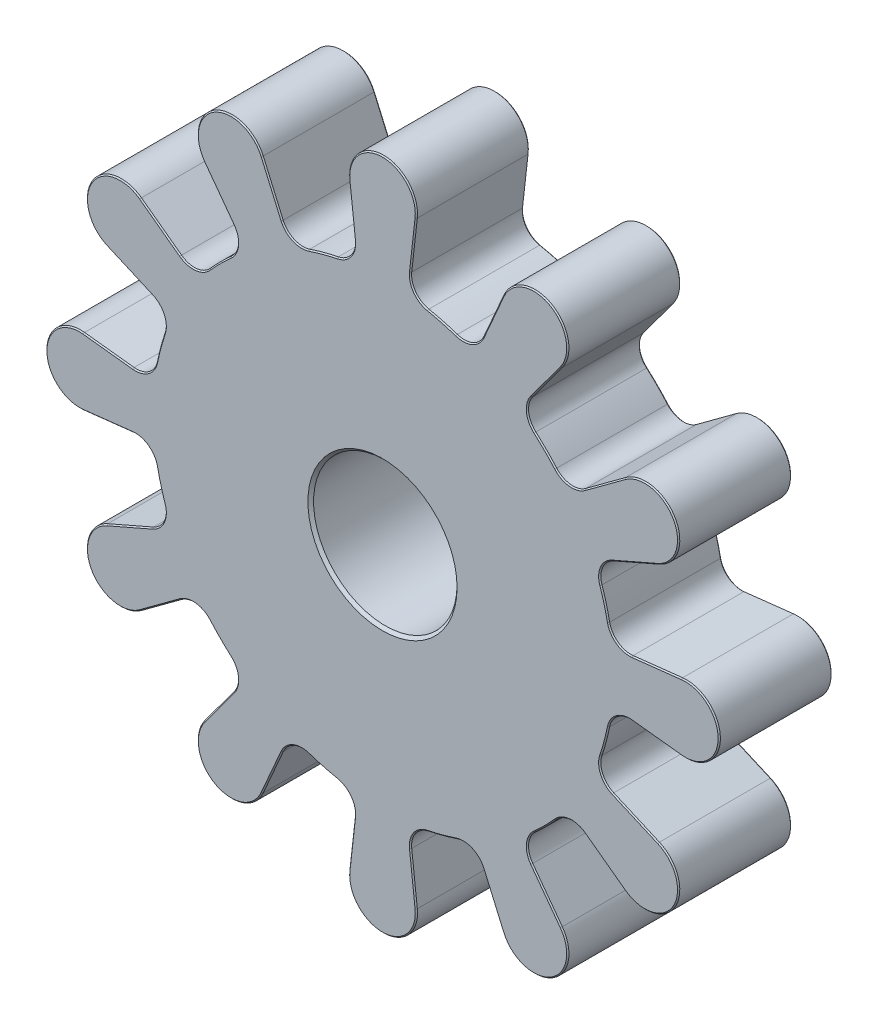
SolidWorks part; units mm, degrees
ref_plane "Спереди" through (0, 0, 0) normal (0, 0, 1) x (1, 0, 0)
ref_plane "Сверху" through (0, 0, 0) normal (0, 1, 0) x (1, 0, 0)
ref_plane "Справа" through (0, 0, 0) normal (1, 0, 0) x (0, 0, -1)
sketch "Эскиз1" plane through (0, 0, 0) normal (0, 0, 1) x (1, 0, 0)
  line L0 (-2.4877, 22.0838) -> (-2.9811, 26.4642)
  line L1 (2.4877, 22.0838) -> (2.9811, 26.4642)
  line L2 (8.8875, 20.369) -> (10.6503, 24.4092)
  line L3 (13.1963, 17.8813) -> (15.8138, 21.4281)
  line L4 (17.8813, 13.1963) -> (21.4281, 15.8138)
  line L5 (20.369, 8.8875) -> (24.4092, 10.6503)
  line L6 (22.0838, 2.4877) -> (26.4642, 2.9811)
  line L7 (22.0838, -2.4877) -> (26.4642, -2.9811)
  line L8 (20.369, -8.8875) -> (24.4092, -10.6503)
  line L9 (17.8813, -13.1963) -> (21.4281, -15.8138)
  line L10 (13.1963, -17.8813) -> (15.8138, -21.4281)
  line L11 (8.8875, -20.369) -> (10.6503, -24.4092)
  line L12 (2.4877, -22.0838) -> (2.9811, -26.4642)
  line L13 (-2.4877, -22.0838) -> (-2.9811, -26.4642)
  line L14 (-8.8875, -20.369) -> (-10.6503, -24.4092)
  line L15 (-13.1963, -17.8813) -> (-15.8138, -21.4281)
  line L16 (-17.8813, -13.1963) -> (-21.4281, -15.8138)
  line L17 (-20.369, -8.8875) -> (-24.4092, -10.6503)
  line L18 (-22.0838, -2.4877) -> (-26.4642, -2.9811)
  line L19 (-22.0838, 2.4877) -> (-26.4642, 2.9811)
  line L20 (-20.369, 8.8875) -> (-24.4092, 10.6503)
  line L21 (-17.8813, 13.1963) -> (-21.4281, 15.8138)
  line L22 (-13.1963, 17.8813) -> (-15.8138, 21.4281)
  line L23 (-8.8875, 20.369) -> (-10.6503, 24.4092)
  line L30 (0, 29.8) -> (0, -29.8) construction
  line L32 (-1.4624, 12.982) -> (-1.5622, 13.8676)
  line L33 (1.4317, 12.7095) -> (1.5689, 13.9272)
  line L34 (2.3239, 11.6557) -> (2.593, 12.5054)
  line L35 (4.9057, 11.2158) -> (5.5263, 12.2724)
  line L36 (6.2004, 11.2432) -> (6.7918, 11.91)
  line L37 (9.0751, 10.1496) -> (10.0717, 10.8624)
  line L38 (11.2208, 9.8112) -> (12.0323, 10.1797)
  line L39 (13.9629, 7.2631) -> (15.1634, 7.5089)
  line L40 (16.2525, 5.5827) -> (17.1438, 5.5893)
  line L41 (17.7555, 1.4461) -> (18.9522, 1.1824)
  line L42 (19.0102, -1.611) -> (19.8271, -1.9675)
  line L43 (18.2626, -6.5503) -> (19.2485, -7.278)
  line L44 (17.6157, -10.1259) -> (18.217, -10.7837)
  line L45 (14.2837, -14.4783) -> (14.8884, -15.544)
  line L46 (11.6517, -17.2868) -> (11.9335, -18.1324)
  line L47 (6.3321, -19.6361) -> (6.4511, -20.8557)
  line L48 (2.4948, -20.5871) -> (2.4082, -21.4742)
  line L49 (-3.4495, -20.0963) -> (-3.8368, -21.2588)
  line L50 (-7.18, -18.812) -> (-7.6198, -19.5872)
  line L51 (-12.1357, -15.5876) -> (-12.9624, -16.4921)
  line L52 (-14.4984, -12.5786) -> (-15.2156, -13.1079)
  line L53 (-17.2328, -7.622) -> (-18.3559, -8.1121)
  line L54 (-17.5696, -4.0382) -> (-18.44, -4.23)
  line L55 (-17.6785, 1.1912) -> (-18.9038, 1.2003)
  line L56 (-16.1808, 4.1039) -> (-17.0539, 4.2827)
  line L57 (-14.148, 8.2966) -> (-15.2637, 8.8033)
  line L58 (-11.6856, 9.756) -> (-12.4105, 10.2745)
  line L59 (-8.5447, 12.2342) -> (-9.3578, 13.1509)
  line L60 (-6.1789, 12.2251) -> (-6.6303, 12.9936)
  line L61 (-2.9665, 13.0878) -> (-3.3364, 14.256)
  line L62 (-2.4877, 22.0838) -> (-2.9811, 26.4642)
  line L63 (2.4877, 22.0838) -> (2.9811, 26.4642)
  line L64 (8.8875, 20.369) -> (10.6503, 24.4092)
  line L65 (13.1963, 17.8813) -> (15.8138, 21.4281)
  line L66 (17.8813, 13.1963) -> (21.4281, 15.8138)
  line L67 (20.369, 8.8875) -> (24.4092, 10.6503)
  circle A0 centre (0, 0) radius 26.8 construction
  arc A1 (2.9811, 26.4642) -> (-2.9811, 26.4642) centre (0, 26.8) ccw
  arc A2 (-4.0066, 20.0027) -> (-6.5315, 19.3261) centre (0, 0) ccw
  arc A3 (15.8138, 21.4281) -> (10.6503, 24.4092) centre (13.4, 23.2095) ccw
  arc A4 (24.4092, 10.6503) -> (21.4281, 15.8138) centre (23.2095, 13.4) ccw
  arc A5 (26.4642, -2.9811) -> (26.4642, 2.9811) centre (26.8, 0) ccw
  arc A6 (21.4281, -15.8138) -> (24.4092, -10.6503) centre (23.2095, -13.4) ccw
  arc A7 (10.6503, -24.4092) -> (15.8138, -21.4281) centre (13.4, -23.2095) ccw
  arc A8 (-2.9811, -26.4642) -> (2.9811, -26.4642) centre (0, -26.8) ccw
  arc A9 (-15.8138, -21.4281) -> (-10.6503, -24.4092) centre (-13.4, -23.2095) ccw
  arc A10 (-24.4092, -10.6503) -> (-21.4281, -15.8138) centre (-23.2095, -13.4) ccw
  arc A11 (-26.4642, 2.9811) -> (-26.4642, -2.9811) centre (-26.8, 0) ccw
  arc A12 (-21.4281, 15.8138) -> (-24.4092, 10.6503) centre (-23.2095, 13.4) ccw
  arc A13 (-10.6503, 24.4092) -> (-15.8138, 21.4281) centre (-13.4, 23.2095) ccw
  arc A17 (6.5315, 19.3261) -> (4.0066, 20.0027) centre (0, 0) ccw
  arc A18 (15.3195, 13.4711) -> (13.4711, 15.3195) centre (0, 0) ccw
  arc A20 (20.0027, 4.0066) -> (19.3261, 6.5315) centre (0, 0) ccw
  arc A21 (-13.4711, 15.3195) -> (-15.3195, 13.4711) centre (0, 0) ccw
  arc A22 (-19.3261, 6.5315) -> (-20.0027, 4.0066) centre (0, 0) ccw
  arc A24 (-20.0027, -4.0066) -> (-19.3261, -6.5315) centre (0, 0) ccw
  arc A25 (-15.3195, -13.4711) -> (-13.4711, -15.3195) centre (0, 0) ccw
  arc A26 (-6.5315, -19.3261) -> (-4.0066, -20.0027) centre (0, 0) ccw
  arc A28 (4.0066, -20.0027) -> (6.5315, -19.3261) centre (0, 0) ccw
  arc A29 (13.4711, -15.3195) -> (15.3195, -13.4711) centre (0, 0) ccw
  arc A30 (19.3261, -6.5315) -> (20.0027, -4.0066) centre (0, 0) ccw
  arc A31 (8.8875, -20.369) -> (6.5315, -19.3261) centre (7.1415, -21.1308) ccw
  arc A32 (2.4877, -22.0838) -> (4.0066, -20.0027) centre (4.3807, -21.8706) cw
  circle A33 centre (0, 0) radius 6.35
  arc A36 (-2.4877, -22.0838) -> (-4.0066, -20.0027) centre (-4.3807, -21.8706) ccw
  arc A37 (-8.8875, -20.369) -> (-6.5315, -19.3261) centre (-7.1415, -21.1308) cw
  arc A38 (-13.1963, -17.8813) -> (-13.4711, -15.3195) centre (-14.7291, -16.7501) ccw
  arc A39 (-17.8813, -13.1963) -> (-15.3195, -13.4711) centre (-16.7501, -14.7291) cw
  arc A40 (-20.369, -8.8875) -> (-19.3261, -6.5315) centre (-21.1308, -7.1415) ccw
  arc A41 (-22.0838, -2.4877) -> (-20.0027, -4.0066) centre (-21.8706, -4.3807) cw
  arc A44 (-22.0838, 2.4877) -> (-20.0027, 4.0066) centre (-21.8706, 4.3807) ccw
  arc A45 (-20.369, 8.8875) -> (-19.3261, 6.5315) centre (-21.1308, 7.1415) cw
  arc A46 (13.1963, -17.8813) -> (13.4711, -15.3195) centre (14.7291, -16.7501) cw
  arc A47 (17.8813, -13.1963) -> (15.3195, -13.4711) centre (16.7501, -14.7291) ccw
  arc A48 (20.369, -8.8875) -> (19.3261, -6.5315) centre (21.1308, -7.1415) cw
  arc A49 (22.0838, -2.4877) -> (20.0027, -4.0066) centre (21.8706, -4.3807) ccw
  arc A50 (20.369, 8.8875) -> (19.3261, 6.5315) centre (21.1308, 7.1415) ccw
  arc A53 (17.8813, 13.1963) -> (15.3195, 13.4711) centre (16.7501, 14.7291) cw
  arc A54 (13.1963, 17.8813) -> (13.4711, 15.3195) centre (14.7291, 16.7501) ccw
  arc A55 (-17.8813, 13.1963) -> (-15.3195, 13.4711) centre (-16.7501, 14.7291) ccw
  arc A56 (-13.1963, 17.8813) -> (-13.4711, 15.3195) centre (-14.7291, 16.7501) cw
  arc A57 (-8.8875, 20.369) -> (-6.5315, 19.3261) centre (-7.1415, 21.1308) ccw
  arc A58 (-2.4877, 22.0838) -> (-4.0066, 20.0027) centre (-4.3807, 21.8706) cw
  arc A59 (8.8875, 20.369) -> (6.5315, 19.3261) centre (7.1415, 21.1308) cw
  arc A60 (2.4877, 22.0838) -> (4.0066, 20.0027) centre (4.3807, 21.8706) ccw
  arc A61 (22.0838, 2.4877) -> (20.0027, 4.0066) centre (21.8706, 4.3807) cw
  arc A66 (2.9811, 26.4642) -> (-2.9811, 26.4642) centre (0, 26.8) ccw
  arc A67 (12.4877, 24.1249) -> (7.0408, 26.55) centre (9.9008, 25.6442) ccw
  arc A68 (20.2208, 18.1212) -> (16.2313, 22.552) centre (18.4756, 20.5613) ccw
  arc A69 (24.8435, 9.4912) -> (23.001, 15.1617) centre (24.2417, 12.4302) ccw
  arc A70 (25.5564, -0.2729) -> (26.1796, 5.6567) centre (26.202, 2.6568) ccw
  arc A71 (22.2362, -9.4828) -> (25.2173, -4.3193) centre (24.0176, -7.069) ccw
  arc A72 (15.4571, -16.5461) -> (20.2807, -13.0415) centre (18.0662, -15.0655) ccw
  arc A73 (6.3911, -20.2414) -> (12.2231, -19.0017) centre (9.3769, -19.95) ccw
  arc A74 (-3.394, -19.9297) -> (2.438, -21.1693) centre (-0.5478, -20.878) ccw
  arc A75 (-12.2064, -15.665) -> (-7.3828, -19.1696) centre (-9.992, -17.689) ccw
  arc A76 (-18.5224, -8.1847) -> (-15.5412, -13.3482) centre (-17.3226, -10.9344) ccw
  arc A77 (-21.2497, 1.2178) -> (-20.6265, -4.7118) centre (-21.2721, -1.7821) ccw
  arc A78 (-19.917, 10.9168) -> (-21.7594, 5.2463) centre (-21.1576, 8.1853) ccw
  arc A79 (-14.7545, 19.2351) -> (-18.744, 14.8043) centre (-16.9988, 17.2444) ccw
  arc A80 (-6.655, 24.7346) -> (-12.1018, 22.3095) centre (-9.515, 23.8288) ccw
  arc A81 (2.9811, 26.4642) -> (-2.9811, 26.4642) centre (0, 26.8) ccw
  arc A82 (15.8138, 21.4281) -> (10.6503, 24.4092) centre (13.4, 23.2095) ccw
  arc A83 (24.4092, 10.6503) -> (21.4281, 15.8138) centre (23.2095, 13.4) ccw
  dimension "D1" = 53.6
  dimension "D2" = 6
  dimension "D3" = 20.4
  dimension "D5" = 12.7
  dimension "D6" = 12
  dimension "D7" = 1.905
  dimension "D8" = 1.905
  dimension "D4" = 15
extrude "Бобышка-Вытянуть1" add sketch "Эскиз1" along normal blind 10
chamfer "Фаска1" distance 0.25 angle 45 2 edges at (6.35, 0, 0) (6.35, 0, 10)
chamfer "Фаска2" distance 0.1 angle 45 144 edges at (14.9, -25.8076, 0) (14.5051, -19.6547, 0) (9.7689, -22.3891, 0) (12.835, -16.5469, 0) (7.9126, -19.3889, 0) (14.425, -14.425, 0) (5.2799, -19.7049, 0) (16.5469, -12.835, 0) (2.842, -20.7475, 0) (19.6547, -14.5051, 0) (2.7344, -24.274, 0) (25.8076, -14.9, 0) (0, -29.8, 0) (22.3891, -9.7689, 0) (-2.7344, -24.274, 0) (19.3889, -7.9126, 0) (-2.842, -20.7475, 0) (19.7049, -5.2799, 0) (-5.2799, -19.7049, 0) (20.7475, -2.842, 0) (-7.9126, -19.3889, 0) (24.274, -2.7344, 0) (-9.7689, -22.3891, 0) (29.8, 0, 0) (-14.9, -25.8076, 0) (24.274, 2.7344, 0) (-14.5051, -19.6547, 0) (20.7475, 2.842, 0) (-12.835, -16.5469, 0) (19.7049, 5.2799, 0) (-14.425, -14.425, 0) (19.3889, 7.9126, 0) (-16.5469, -12.835, 0) (22.3891, 9.7689, 0) (-19.6547, -14.5051, 0) (25.8076, 14.9, 0) (-25.8076, -14.9, 0) (19.6547, 14.5051, 0) (-22.3891, -9.7689, 0) (16.5469, 12.835, 0) (-19.3889, -7.9126, 0) (14.425, 14.425, 0) (-19.7049, -5.2799, 0) (12.835, 16.5469, 0) (-20.7475, -2.842, 0) (14.5051, 19.6547, 0) (-24.274, -2.7344, 0) (14.9, 25.8076, 0) (-29.8, 0, 0) (9.7689, 22.3891, 0) (-24.274, 2.7344, 0) (7.9126, 19.3889, 0) (-20.7475, 2.842, 0) (5.2799, 19.7049, 0) (-19.7049, 5.2799, 0) (2.842, 20.7475, 0) (-19.3889, 7.9126, 0) (2.7344, 24.274, 0) (-22.3891, 9.7689, 0) (0, 29.8, 0) (-25.8076, 14.9, 0) (-2.7344, 24.274, 0) (-19.6547, 14.5051, 0) (-2.842, 20.7475, 0) (-16.5469, 12.835, 0) (-5.2799, 19.7049, 0) (-14.425, 14.425, 0) (-7.9126, 19.3889, 0) (-12.835, 16.5469, 0) (-9.7689, 22.3891, 0) (-14.5051, 19.6547, 0) (-14.9, 25.8076, 0) (14.9, -25.8076, 10) (14.5051, -19.6547, 10) (9.7689, -22.3891, 10) (12.835, -16.5469, 10) (7.9126, -19.3889, 10) (14.425, -14.425, 10) (5.2799, -19.7049, 10) (16.5469, -12.835, 10) (2.842, -20.7475, 10) (19.6547, -14.5051, 10) (2.7344, -24.274, 10) (25.8076, -14.9, 10) (0, -29.8, 10) (22.3891, -9.7689, 10) (-2.7344, -24.274, 10) (19.3889, -7.9126, 10) (-2.842, -20.7475, 10) (19.7049, -5.2799, 10) (-5.2799, -19.7049, 10) (20.7475, -2.842, 10) (-7.9126, -19.3889, 10) (24.274, -2.7344, 10) (-9.7689, -22.3891, 10) (29.8, 0, 10) (-14.9, -25.8076, 10) (24.274, 2.7344, 10) (-14.5051, -19.6547, 10) (20.7475, 2.842, 10) (-12.835, -16.5469, 10) (19.7049, 5.2799, 10) (-14.425, -14.425, 10) (19.3889, 7.9126, 10) (-16.5469, -12.835, 10) (22.3891, 9.7689, 10) (-19.6547, -14.5051, 10) (25.8076, 14.9, 10) (-25.8076, -14.9, 10) (19.6547, 14.5051, 10) (-22.3891, -9.7689, 10) (16.5469, 12.835, 10) (-19.3889, -7.9126, 10) (14.425, 14.425, 10) (-19.7049, -5.2799, 10) (12.835, 16.5469, 10) (-20.7475, -2.842, 10) (14.5051, 19.6547, 10) (-24.274, -2.7344, 10) (14.9, 25.8076, 10) (-29.8, 0, 10) (9.7689, 22.3891, 10) (-24.274, 2.7344, 10) (7.9126, 19.3889, 10) (-20.7475, 2.842, 10) (5.2799, 19.7049, 10) (-19.7049, 5.2799, 10) (2.842, 20.7475, 10) (-19.3889, 7.9126, 10) (2.7344, 24.274, 10) (-22.3891, 9.7689, 10) (0, 29.8, 10) (-25.8076, 14.9, 10) (-2.7344, 24.274, 10) (-19.6547, 14.5051, 10) (-2.842, 20.7475, 10) (-16.5469, 12.835, 10) (-5.2799, 19.7049, 10) (-14.425, 14.425, 10) (-7.9126, 19.3889, 10) (-12.835, 16.5469, 10) (-9.7689, 22.3891, 10) (-14.5051, 19.6547, 10) (-14.9, 25.8076, 10)
